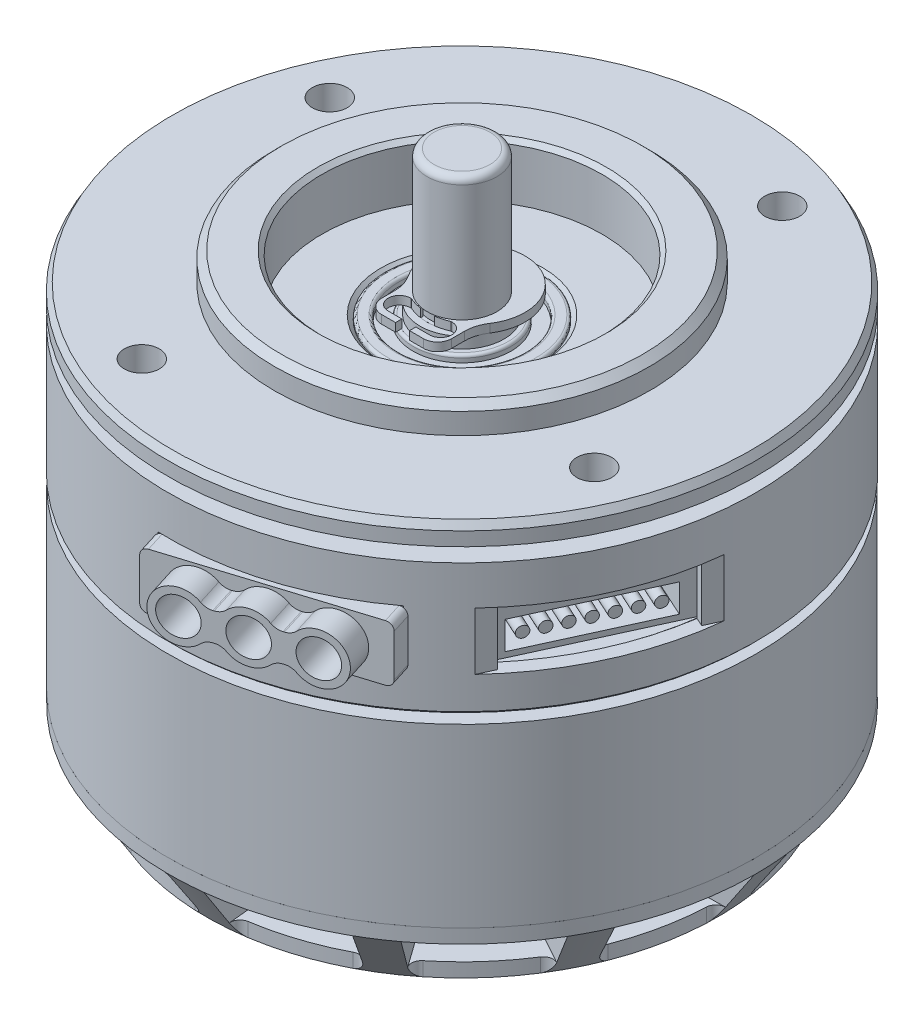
SolidWorks part; units mm, degrees
ref_plane "前视基准面" through (0, 0, 0) normal (0, 0, 1) x (1, 0, 0)
ref_plane "上视基准面" through (0, 0, 0) normal (0, 1, 0) x (1, 0, 0)
ref_plane "右视基准面" through (0, 0, 0) normal (1, 0, 0) x (0, 0, -1)
imported_body "YC.WJ.Z00524 WM610- 3510电机磁轭-1-solid1"
imported_body "YC.DZ.M00031    3508电机铁芯-1-solid1"
imported_body "YC.WJ.Z00526 WM610- 3510电机瓦型磁钢（N）YC.WJ.Z00527WM610- 3510电机瓦型磁钢（S）-1-solid1"
imported_body "YC.WJ.CC000004.01 WS2017 M3508减速电机轴19-1 V1-2-solid1"
imported_body "YC.WJ.LP000000.01 WS2017 M3508 减速电机5mm铜套V1-1-solid1"
imported_body "YC.WJ.C00072 NMB685ZZ轴承-1-solid1"
imported_body "YC.WJ.C00072 NMB685ZZ轴承-2-solid1"
imported_body "YC.WJ.K00119.02 WM610- 3510电机上盖V2-1-solid1"
imported_body "YC.WJ.ZZ000081.01 WS2017 M3508减速电机底座 V1-2-solid1"
imported_body "YC.WJ.Z00526 WM610- 3510电机瓦型磁钢（N）YC.WJ.Z00527WM610- 3510电机瓦型磁钢（S）-2-solid1"
imported_body "YC.WJ.Z00526 WM610- 3510电机瓦型磁钢（N）YC.WJ.Z00527WM610- 3510电机瓦型磁钢（S）-3-solid1"
imported_body "YC.WJ.Z00526 WM610- 3510电机瓦型磁钢（N）YC.WJ.Z00527WM610- 3510电机瓦型磁钢（S）-4-solid1"
imported_body "YC.WJ.Z00526 WM610- 3510电机瓦型磁钢（N）YC.WJ.Z00527WM610- 3510电机瓦型磁钢（S）-5-solid1"
imported_body "YC.WJ.Z00526 WM610- 3510电机瓦型磁钢（N）YC.WJ.Z00527WM610- 3510电机瓦型磁钢（S）-6-solid1"
imported_body "YC.WJ.Z00526 WM610- 3510电机瓦型磁钢（N）YC.WJ.Z00527WM610- 3510电机瓦型磁钢（S）-7-solid1"
imported_body "YC.WJ.Z00526 WM610- 3510电机瓦型磁钢（N）YC.WJ.Z00527WM610- 3510电机瓦型磁钢（S）-8-solid1"
imported_body "YC.WJ.Z00526 WM610- 3510电机瓦型磁钢（N）YC.WJ.Z00527WM610- 3510电机瓦型磁钢（S）-9-solid1"
imported_body "YC.WJ.Z00526 WM610- 3510电机瓦型磁钢（N）YC.WJ.Z00527WM610- 3510电机瓦型磁钢（S）-10-solid1"
imported_body "YC.WJ.Z00526 WM610- 3510电机瓦型磁钢（N）YC.WJ.Z00527WM610- 3510电机瓦型磁钢（S）-11-solid1"
imported_body "YC.WJ.Z00526 WM610- 3510电机瓦型磁钢（N）YC.WJ.Z00527WM610- 3510电机瓦型磁钢（S）-12-solid1"
imported_body "YC.WJ.Z00526 WM610- 3510电机瓦型磁钢（N）YC.WJ.Z00527WM610- 3510电机瓦型磁钢（S）-13-solid1"
imported_body "YC.WJ.Z00526 WM610- 3510电机瓦型磁钢（N）YC.WJ.Z00527WM610- 3510电机瓦型磁钢（S）-14-solid1"
imported_body "WS2017 M3508 减速电机 霍尔板-1-solid1"
imported_body "WS2017 M3508 减速电机 霍尔板-1-solid2"
imported_body "WS2017 M3508 减速电机 霍尔板-1-solid3"
imported_body "WS2017 M3508 减速电机 霍尔板-1-solid4"
imported_body "WS2017 M3508 减速电机 霍尔板-1-solid5"
imported_body "YC.SJ.WS000075.01 WS2017 M3508减速电机垫圈V1-1-solid1"
imported_body "YC.WJ.ZZ000038.01 WS2017 M3508减速电机 减速箱V1-1/WS2017 M3508 19-1减速箱-1-solid1"
imported_body "YC.WJ.ZZ000038.01 WS2017 M3508减速电机 减速箱V1-1/1025-0001 上盖板-1-solid1"
imported_body "YC.WJ.ZZ000038.01 WS2017 M3508减速电机 减速箱V1-1/卡簧-1-solid1"
imported_body "YC.WJ.ZZ000038.01 WS2017 M3508减速电机 减速箱V1-1/轴承22-10-6-1/轴承22-10-6-1-solid1"
imported_body "YC.WJ.ZZ000038.01 WS2017 M3508减速电机 减速箱V1-1/轴承22-10-6-1/轴承22-10-6挡片-1-solid1"
imported_body "YC.WJ.ZZ000038.01 WS2017 M3508减速电机 减速箱V1-1/轴承22-10-6-1/轴承22-10-6挡片-2-solid1"
imported_body "YC.WJ.ZZ000038.01 WS2017 M3508减速电机 减速箱V1-1/轴承22-10-6-2/轴承22-10-6-1-solid1"
imported_body "YC.WJ.ZZ000038.01 WS2017 M3508减速电机 减速箱V1-1/轴承22-10-6-2/轴承22-10-6挡片-1-solid1"
imported_body "YC.WJ.ZZ000038.01 WS2017 M3508减速电机 减速箱V1-1/轴承22-10-6-2/轴承22-10-6挡片-2-solid1"
imported_body "YC.WJ.ZZ000038.01 WS2017 M3508减速电机 减速箱V1-1/1025-0045输出轴（大疆）-1-solid1"
imported_body "YC.WJ.ZZ000038.01 WS2017 M3508减速电机 减速箱V1-1/垫圈-1-solid1"
imported_body "YC.WJ.ZZ000038.01 WS2017 M3508减速电机 减速箱V1-1/M3螺钉-1-solid1"
imported_body "YC.WJ.ZZ000038.01 WS2017 M3508减速电机 减速箱V1-1/M3螺钉-2-solid1"
imported_body "YC.WJ.ZZ000038.01 WS2017 M3508减速电机 减速箱V1-1/M3螺钉-3-solid1"
imported_body "YC.WJ.ZZ000038.01 WS2017 M3508减速电机 减速箱V1-1/M3螺钉-4-solid1"
imported_body "RM3510减速电机垫片-1-solid1"
imported_body "YC.WJ.L01016.00     φ5 轴用弹性挡圈 C型卡簧-2-solid1"
imported_body "YC.SJ.WS000073.01 WS2017 M3508线卡V1-1-solid1"
imported_body "WS2017 C620三相动力线组件-1/MR30 3D M-1-surface1" [suppressed]
imported_body "WS2017 C620三相动力线组件-1/MR30 3D M-1-surface2" [suppressed]
imported_body "WS2017 C620三相动力线组件-1/MR30 3D M-1-surface3" [suppressed]
imported_body "WS2017 C620三相动力线组件-1/MR30 3D M-1-surface4" [suppressed]
imported_body "WS2017 C620三相动力线组件-1/MR30 3D M-1-surface5" [suppressed]
imported_body "WS2017 C620三相动力线组件-1/MR30 3D M-1-surface6" [suppressed]
imported_body "WS2017 C620三相动力线组件-1/MR30 3D M-1-surface7" [suppressed]
imported_body "WS2017 C620三相动力线组件-1/MR30 3D M-1-surface8" [suppressed]
imported_body "WS2017 C620三相动力线组件-1/MR30 3D M-1-surface9" [suppressed]
imported_body "WS2017 C620三相动力线组件-1/MR30 3D M-1-surface10" [suppressed]
imported_body "WS2017 C620三相动力线组件-1/MR30 3D M-1-surface11" [suppressed]
imported_body "WS2017 C620三相动力线组件-1/MR30 3D M-1-surface12" [suppressed]
imported_body "WS2017 C620三相动力线组件-1/MR30 3D M-1-surface13" [suppressed]
imported_body "WS2017 C620三相动力线组件-1/MR30 3D M-1-surface14" [suppressed]
imported_body "WS2017 C620三相动力线组件-1/MR30 3D M-1-surface15" [suppressed]
imported_body "WS2017 C620三相动力线组件-1/MR30 3D M-1-surface16" [suppressed]
imported_body "WS2017 C620三相动力线组件-1/YC.XC.DD000004.01 WS2017 M3508 耐高温硅胶线（黑色）_动力线V1-1-solid1" [suppressed]
imported_body "WS2017 C620三相动力线组件-1/YC.XC.DD000004.01 WS2017 M3508 耐高温硅胶线（黑色）_动力线V1-2-solid1" [suppressed]
imported_body "WS2017 C620三相动力线组件-1/YC.XC.DD000004.01 WS2017 M3508 耐高温硅胶线（黑色）_动力线V1-3-solid1" [suppressed]
imported_body "WS2017 C620三相动力线组件-1/MR30 3D 护套-1-surface1" [suppressed]
move or copy body "实体-移动/复制3" bodies to move or copy 135 118 145 106 136 150 126 148 132 107 121 128 109 116 141 124 134 144 138 112 119 147 113 127 114 108 122 105 111 133 117 140 130 125 143 137 146 131 149 120 placed by mates yes parameters "D1"=0, "D2"=0, "D3"=0
move or copy body "实体-移动/复制5" bodies to move or copy 153 162 158 151 161 157 160 156 170 165 166 154 163 155 159 164 152 167 168 169 placed by mates yes parameters "D1"=0, "D2"=0, "D3"=0
delete or keep bodies "实体-删除/保留 1" type keep bodies bodies 201 196 179 199 193 215 186 212 185 217 197 182 211 202 175 204 187 177 214 198 183 180 207 189 218 200 213 184 194
move or copy body "实体-移动/复制4" [suppressed] bodies to move or copy 191 205 219 195 209 216 188 178 176 190 192 174 208 210 203 copy no translate (0, 3, 0) parameters "D1"=0, "D2"=3, "D3"=0
delete or keep bodies "实体-删除/保留 2" [suppressed] type delete bodies bodies 238 244 243 237 251 249 236 247 245 239 242 250 241 248 235 246 240 254 252 253
sketch "Sketch1" plane through (0, 30.1, 0) normal (0, 1, 0) x (1, 0, 0)
  circle A0 centre (6.7126, 16.1614) radius 3
  circle A1 centre (16.1614, -6.7126) radius 3
  circle A2 centre (-6.7126, -16.1614) radius 3
  circle A3 centre (-16.1614, 6.7126) radius 3
  point P12 (0, 0)
  dimension "D1" = 6
  dimension "D2" = 4
